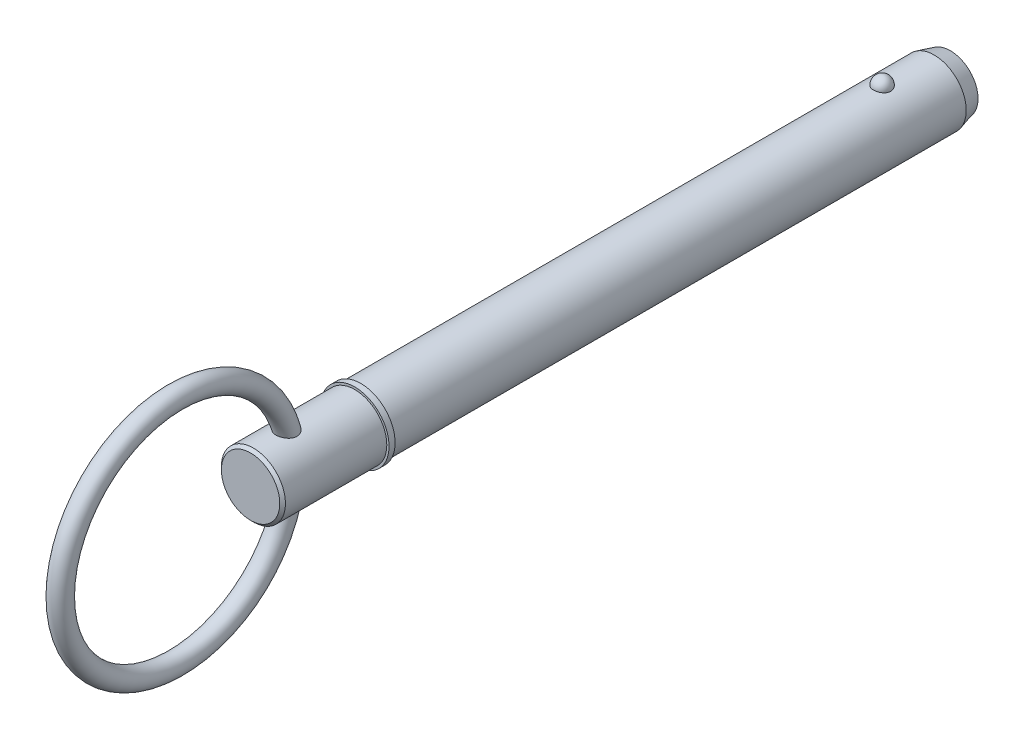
SolidWorks part; units mm, degrees
ref_plane "Front Plane" through (0, 0, 0) normal (0, 0, 1) x (1, 0, 0)
ref_plane "Top Plane" through (0, 0, 0) normal (0, 1, 0) x (1, 0, 0)
ref_plane "Right Plane" through (0, 0, 0) normal (1, 0, 0) x (0, 0, -1)
sketch "Sketch2" plane through (0, 0, 0) normal (0, 0, 1) x (1, 0, 0)
  circle A0 centre (0, 0) radius 7.94
  point P3 (0, 7.94)
  dimension "D1" = 15.88
extrude "Boss-Extrude1" add sketch "Sketch2" along normal blind 127
sketch "Sketch3" plane through (0, 0, 0) normal (0, 0, -1) x (-1, 0, 0)
  circle A0 centre (0, 0) radius 7.94
  dimension "D1" = 15.88
extrude "Boss-Extrude2" add sketch "Sketch3" along normal blind 19.05
chamfer "Chamfer1" distance 4 angle 15 1 edges at (-7.94, 0, -19.05)
sketch "Sketch18" plane through (0, 0, 0) normal (1, 0, 0) x (0, 0, -1)
  line L0 (15.05, 7.94) -> (-127, 7.94) construction
  line L1 (2.15, 10.09) -> (2.15, 5.79)
  line L2 (-127, -7.94) -> (15.05, -7.94) construction
  arc A0 (2.15, 10.09) -> (2.15, 5.79) centre (2.15, 7.94) ccw
  point P4 (0, 7.94)
  dimension "D1" = 18.03
revolve "Revolve1" add sketch "Sketch18" angle 360 about L1
sketch "Sketch19" plane through (0, 0, 0) normal (1, 0, 0) x (0, 0, -1)
  line L0 (-33.7288, 0) -> (-46.4542, 0) construction
sketch "Sketch20" plane through (0, 0, 0) normal (1, 0, 0) x (0, 0, -1)
  line L0 (-127, 0) -> (-127, 8.5)
  line L1 (-127, 7.94) -> (-127, -7.94) construction
  line L2 (-127, 8.5) -> (-128.5, 8.5)
  line L3 (-128.5, 8.5) -> (-128.5, 0)
  line L4 (-33.7288, 0) -> (-46.4542, 0) construction
  line L5 (-128.5, 0) -> (-127, 0)
  dimension "D1" = 8.5
  dimension "D2" = 1.5
revolve "Revolve2" add sketch "Sketch20" angle 360 about L0
sketch "Sketch21" plane through (0, 0, 127) normal (0, 0, -1) x (-1, 0, 0)
  circle A0 centre (0, 0) radius 7.94
  dimension "D1" = 15.88
extrude "Boss-Extrude3" add sketch "Sketch21" against normal blind 27.31
chamfer "Chamfer2" distance 0.7 angle 45 1 edges at (-7.94, 0, 154.31)
sketch "Sketch23" plane through (0, 0, 0) normal (1, 0, 0) x (0, 0, -1)
  line L0 (-154.31, 7.24) -> (-154.31, -7.24) construction
  circle A0 centre (-172.885, 0) radius 28.575
  point P2 (-144.31, 0)
  dimension "D1" = 57.15
  dimension "D2" = 10
sketch "Sketch24" plane through (0, 0, 0) normal (0, 1, 0) x (1, 0, 0)
  circle A0 centre (0, -144.31) radius 2.5
  dimension "D1" = 5
sweep "Sweep1" add profiles "Sketch24" path "Sketch23"
